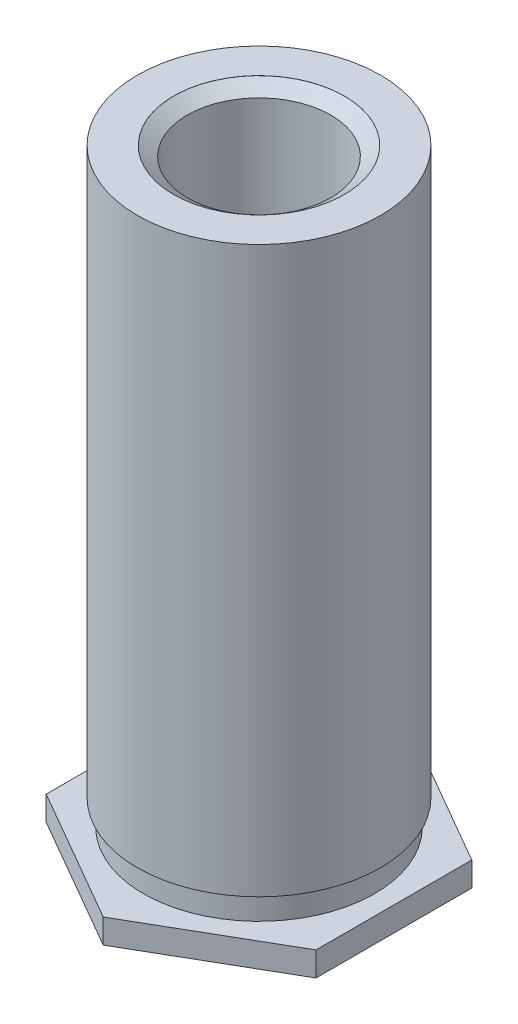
SolidWorks part; units mm, degrees
ref_plane "Plane1" through (0, 0, 0) normal (0, 0, 1) x (1, 0, 0)
ref_plane "Plane2" through (0, 0, 0) normal (0, 1, 0) x (1, 0, 0)
ref_plane "Plane3" through (0, 0, 0) normal (1, 0, 0) x (0, 0, -1)
sketch "BodySke" plane through (0, 0, 0) normal (0, 0, 1) x (1, 0, 0)
  line L0 (3.56, 0) -> (4.582, 0)
  line L1 (4.582, 0) -> (4.582, 0.712)
  line L2 (4.582, 0.712) -> (3.382, 0.712)
  line L3 (2.1, 18) -> (2.1, 8.5)
  line L4 (3.56, 1.4596) -> (3.382, 1.4596)
  line L5 (3.382, 1.4596) -> (3.382, 0.712)
  line L6 (3.56, 0.0025) -> (3.56, 0)
  line L7 (1.016, 17.2) -> (3.6522, 17.2) construction
  line L8 (3.56, 18) -> (2.1, 18)
  line L9 (0, 0) -> (0, 15.24) construction
  line L10 (3.56, 0.0025) -> (0, 0.0025)
  line L11 (3.56, 18) -> (3.56, 1.4596)
  line L12 (0, 8.5) -> (2.1, 8.5)
  line L13 (0, 8.5) -> (0, 0.0025)
  line L14 (1.016, 8.5) -> (3.6522, 8.5) construction
  line L15 (1.016, 8.5) -> (3.6522, 8.5) construction
  dimension "D1" = 0.0025
  dimension "E_dia" = 9.164
  dimension "C_dia" = 7.12
  dimension "Thread_min" = 4.2
  dimension "Clinching_ht" = 0.712
  dimension "Advance" = 0.8
  dimension "Length" = 18
  dimension "Thread_limit" = 9.5
  dimension "Thread_depth" = 9.5
  dimension "Drill_depth" = 9.5
  dimension "Groove_wid" = 0.7476
  dimension "Groove_dia" = 6.764
revolve "Body" add sketch "BodySke"
revolve "EndChamfer" cut sketch "EndChamferSke" angle 360 about L0
sketch "EndChamferSke" plane through (0, 0, 0) normal (0, 0, 1) x (1, 0, 0)
  line L0 (0, -2.54) -> (0, 7.62) construction
  line L1 (0, 0) -> (0, 15.24) construction
  line L6 (2.5, 17.9975) -> (2.1, 17.7175)
  line L7 (2.5, 17.9975) -> (2.5, 18.254)
  line L8 (2.1, 17.7175) -> (2.1, 18.254)
  line L9 (2.5, 18.254) -> (2.1, 18.254)
  line L10 (3.56, 18) -> (-3.56, 18) construction
  dimension "D1" = 0.254
  dimension "Thread_nominal" = 5
  dimension "D2" = 34.99
  dimension "Thread_min" = 4.2
  dimension "Inset" = 0.0025
revolve "TapDrill" cut sketch "TapDriSke" angle 360 about L0
sketch "TapDriSke" plane through (0, 0, 0) normal (0, 0, 1) x (1, 0, 0)
  line L0 (0, 0) -> (0, 15.24) construction
  line L1 (0, 0) -> (0, 15.24) construction
  line L2 (2.1, 4.5) -> (2.1, 18)
  line L3 (3.56, 18) -> (-3.56, 18) construction
  line L4 (2.1, 4.5) -> (0, 3.6302)
  line L5 (0, 3.6302) -> (0, 18)
  line L6 (0, 18) -> (2.1, 18)
  line L7 (2.1, 8.5) -> (2.1, 18) construction
  line L8 (0, 3.6302) -> (-2.1, 4.5) construction
  line L9 (-2.1, 18) -> (-2.1, 8.5) construction
  line L10 (0, 1.4596) -> (4.826, 1.4596) construction
  dimension "D1" = 135
  dimension "Depth" = 13.5
  dimension "Drill_limit" = 16.5404
ref_plane "Plane4" through (0, -0.5486, 0) normal (0, 1, 0) x (-1, 0, 0)
sketch "ThdSchSke" plane through (0, 0, 0) normal (0, 0, 1) x (1, 0, 0)
  line L0 (0, -5.08) -> (0, 7.62) construction
  line L1 (0, 0) -> (0, 15.24) construction
  line L2 (0, 17.9975) -> (2.5, 17.9975) construction
  line L3 (2.5, 17.9975) -> (-2.5, 17.9975) construction
  line L4 (2.5, 17.9975) -> (2.1, 18.2775)
  line L6 (2.5, 17.9975) -> (2.1, 17.7174)
  line L7 (2.1, 18.2775) -> (2.1, 17.7174)
  dimension "Vee_angle" = 70
  dimension "Thread_nominal" = 5
  dimension "Thread_min" = 4.2
revolve "ThreadSchematic" [suppressed] cut sketch "ThdSchSke" angle 360 about L0
pattern_linear "ThdSchPat" [suppressed]
sketch "HexDieSke" plane through (0, 0.712, 0) normal (0, 1, 0) x (-1, 0, 0)
  line L0 (0, 4.5611) -> (3.95, 2.2805)
  line L1 (3.95, 2.2805) -> (3.95, -2.2805)
  line L2 (3.95, -2.2805) -> (0, -4.5611)
  line L3 (0, -4.5611) -> (-3.95, -2.2805)
  line L4 (-3.95, -2.2805) -> (-3.95, 2.2805)
  line L5 (-3.95, 2.2805) -> (0, 4.5611)
  circle A1 centre (0, 0) radius 3.95 construction
  circle A2 centre (0, 0) radius 4.5611 construction
  circle A3 centre (0, 0) radius 4.5825
  dimension "Width_across_flats" = 7.9
  dimension "OD" = 9.165
extrude "HexDie" cut sketch "HexDieSke" against normal blind 0.712
equation "' \"Length@BodySke\" = 18"
equation "' \"C_dia@BodySke\" = 7.12"
equation "' \"Width_across_flats@HexDieSke\" = 7.9"
equation "' \"Thread_depth@BodySke\" = 9.5"
equation "' \"Advance@BodySke\" = 0.8"
equation "' \"Thread_min@BodySke\" = 4.2"
equation "' \"Thread_nominal@ThreadCosmetic\" = 5"
equation "\"E_dia@BodySke\" = \"Width_across_flats@HexDieSke\" * 1.16"
equation "\"Clinching_ht@BodySke\" = \"C_dia@BodySke\" * 0.1"
equation "\"Groove_dia@BodySke\" = \"C_dia@BodySke\" * 0.95"
equation "\"Groove_wid@BodySke\" = \"Clinching_ht@BodySke\" * 1.05"
equation "\"Drill_depth@BodySke\" = \"Thread_depth@BodySke\""
equation "\"Drill_limit@TapDriSke\" = \"Length@BodySke\" - \"Clinching_ht@BodySke\" - \"Groove_wid@BodySke\""
equation "\"Thread_limit@BodySke\" = ((sgn( \"Length@BodySke\" - \"Thread_depth@BodySke\" )-1)*( \"Length@BodySke\" - \"Thread_depth@BodySke\" ))/-2+ \"Thread_depth@BodySke\""
equation "\"Depth@TapDriSke\" = \"Thread_limit@BodySke\" + \"Advance@BodySke\" * 5"
equation "\"Depth@TapDriSke\" = ((sgn( \"Depth@TapDriSke\" - \"Drill_limit@TapDriSke\" )-1)*( \"Depth@TapDriSke\" - \"Drill_limit@TapDriSke\" ))/-2+ \"Drill_limit@TapDriSke\""
equation "\"Depth@HexDie\" = \"Clinching_ht@BodySke\""
equation "\"OD@HexDieSke\" =  \"Width_across_flats@HexDieSke\" * 1.16 + 0.001"
equation "\"Thread_nominal@EndChamferSke\" = \"Thread_nominal@ThreadCosmetic\""
equation "\"Thread_min@EndChamferSke\" = \"Thread_min@BodySke\""
equation "\"D2@EndChamferSke\" = \"Vee_angle@ThdSchSke\" / 2 - 0.01"
equation "\"Thread_nominal@ThdSchSke\" = \"Thread_nominal@ThreadCosmetic\""
equation "\"Thread_min@ThdSchSke\" = \"Thread_min@BodySke\""
equation "\"Num_threads@ThdSchPat\" = int(  ( \"Thread_limit@BodySke\" - \"Inset@EndChamferSke\" ) / \"Advance@BodySke\" + 0.999 )  + 1"
equation "\"Advance@ThdSchPat\" = (  \"Thread_limit@BodySke\" - \"Inset@EndChamferSke\" ) /  (\"Num_threads@ThdSchPat\" - 1) 'relax it"
